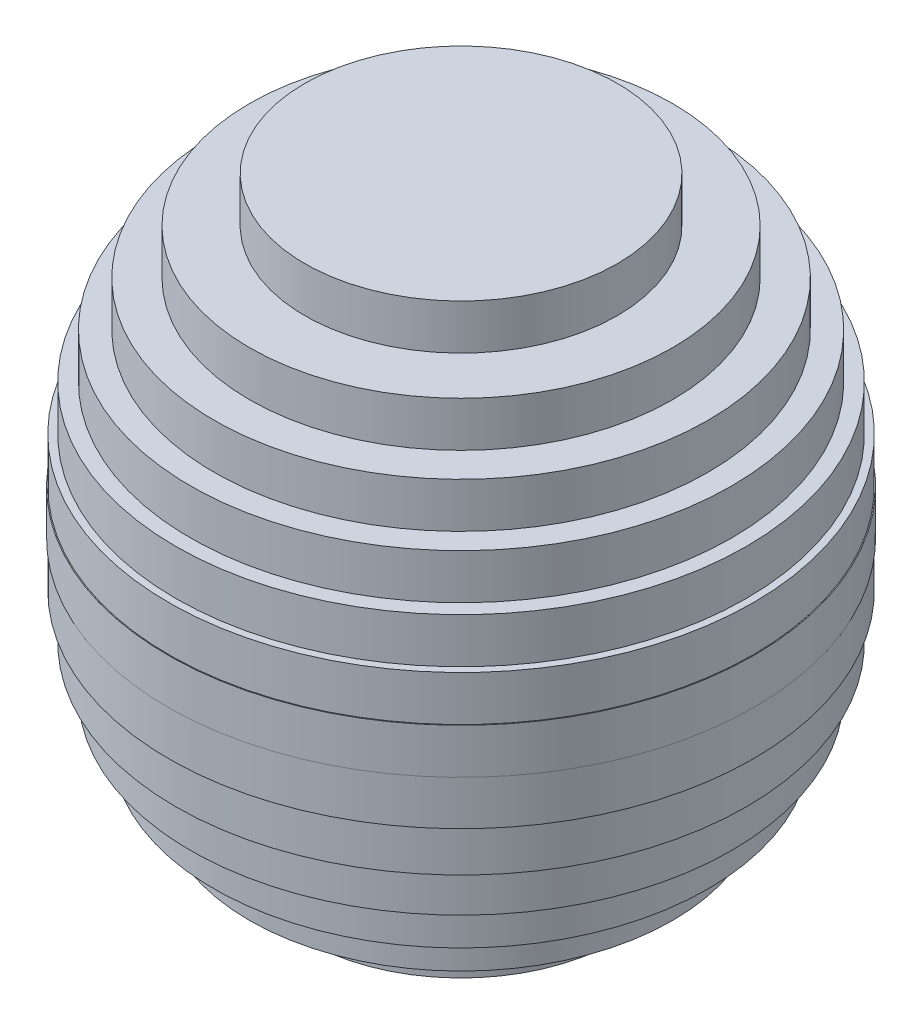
SolidWorks part; units mm, degrees
ref_plane "Front Plane" through (0, 0, 0) normal (0, 0, 1) x (1, 0, 0)
ref_plane "Top Plane" through (0, 0, 0) normal (0, 1, 0) x (1, 0, 0)
ref_plane "Right Plane" through (0, 0, 0) normal (1, 0, 0) x (0, 0, -1)
sketch "Sketch1" plane through (0, 0, 0) normal (0, 0, 1) x (1, 0, 0)
  line L0 (0, -32.5) -> (0, 32.5) construction
  line L1 (0, -32.5) -> (32.5, -32.5) construction
  line L2 (0, -27.5) -> (32.5, -27.5) construction
  line L3 (0, -22.5) -> (32.5, -22.5) construction
  line L4 (0, -17.5) -> (32.5, -17.5) construction
  line L5 (0, -12.5) -> (32.5, -12.5) construction
  line L6 (0, -7.5) -> (32.5, -7.5) construction
  line L7 (0, -2.5) -> (32.5, -2.5) construction
  line L8 (0, 2.5) -> (32.5, 2.5) construction
  line L9 (0, 7.5) -> (32.5, 7.5) construction
  line L10 (0, 12.5) -> (32.5, 12.5) construction
  line L11 (0, 17.5) -> (32.5, 17.5) construction
  line L12 (0, 22.5) -> (32.5, 22.5) construction
  line L13 (0, 27.5) -> (32.5, 27.5) construction
  arc A0 (0, 32.5) -> (0, -32.5) centre (0, 0) cw construction
  point P4 (0, 0)
  point P7 (32.5, 0)
  point P8 (0, 32.5)
sketch "Sketch4" plane through (0, 0, 0) normal (0, 0, 1) x (1, 0, 0)
  line L53 (32.4037, -2.5) -> (32.4037, -7.5)
  line L54 (32.4037, -7.5) -> (31.6228, -7.5)
  line L55 (0, -7.5) -> (32.5, -7.5) construction
  line L56 (31.6228, -7.5) -> (31.6228, -12.5)
  line L57 (0, -12.5) -> (32.5, -12.5) construction
  line L58 (31.6228, -12.5) -> (30, -12.5)
  line L59 (30, -12.5) -> (30, -17.5)
  line L60 (0, -17.5) -> (32.5, -17.5) construction
  line L61 (30, -17.5) -> (27.3861, -17.5)
  line L62 (27.3861, -17.5) -> (27.3861, -22.5)
  line L63 (0, -22.5) -> (32.5, -22.5) construction
  line L64 (27.3861, -22.5) -> (23.4521, -22.5)
  line L65 (23.4521, -22.5) -> (23.4521, -27.5)
  line L66 (0, -27.5) -> (32.5, -27.5) construction
  line L67 (23.4521, -27.5) -> (17.3205, -27.5)
  line L68 (17.3205, -27.5) -> (17.3205, -32.5)
  line L69 (0, -32.5) -> (32.5, -32.5) construction
  line L70 (17.3205, -32.5) -> (0, -32.5)
  line L71 (0, -32.5) -> (0, 32.5)
  line L72 (0, -2.5) -> (32.5, -2.5) construction
  line L73 (32.4037, -2.5) -> (32.5, -2.5)
  line L74 (32.5, -2.5) -> (32.5, 2.5)
  line L75 (32.5, 2.5) -> (32.4037, 2.5)
  line L76 (0, 2.5) -> (32.5, 2.5) construction
  line L77 (32.4037, 2.5) -> (32.4037, 7.5)
  line L78 (0, 7.5) -> (32.5, 7.5) construction
  line L79 (32.4037, 7.5) -> (31.6228, 7.5)
  line L80 (31.6228, 7.5) -> (31.6228, 12.5)
  line L81 (0, 12.5) -> (32.5, 12.5) construction
  line L82 (31.6228, 12.5) -> (30, 12.5)
  line L83 (30, 12.5) -> (30, 17.5)
  line L84 (0, 17.5) -> (32.5, 17.5) construction
  line L85 (30, 17.5) -> (27.3861, 17.5)
  line L86 (27.3861, 17.5) -> (27.3861, 22.5)
  line L87 (0, 22.5) -> (32.5, 22.5) construction
  line L88 (27.3861, 22.5) -> (23.4521, 22.5)
  line L89 (23.4521, 22.5) -> (23.4521, 27.5)
  line L90 (0, 27.5) -> (32.5, 27.5) construction
  line L91 (23.4521, 27.5) -> (17.3205, 27.5)
  line L92 (17.3205, 27.5) -> (17.3205, 32.5)
  line L93 (17.3205, 32.5) -> (0, 32.5)
  arc A1 (0, -32.5) -> (0, 32.5) centre (0, 0) ccw construction
revolve "Revolve1" add sketch "Sketch4" angle 360 about L71
equation "\"Ball Diameter\"= 65"
equation "\"Layers\"= \"Ball Diameter\" / \"Layer Height\""
equation "\"D1@Sketch1\"=\"Ball Diameter\""
equation "\"Layer Height\"= 5mm"
equation "\"D3@Sketch1\"=\"Layer Height\""
equation "\"D2@Sketch1\"=\"Layers\""
